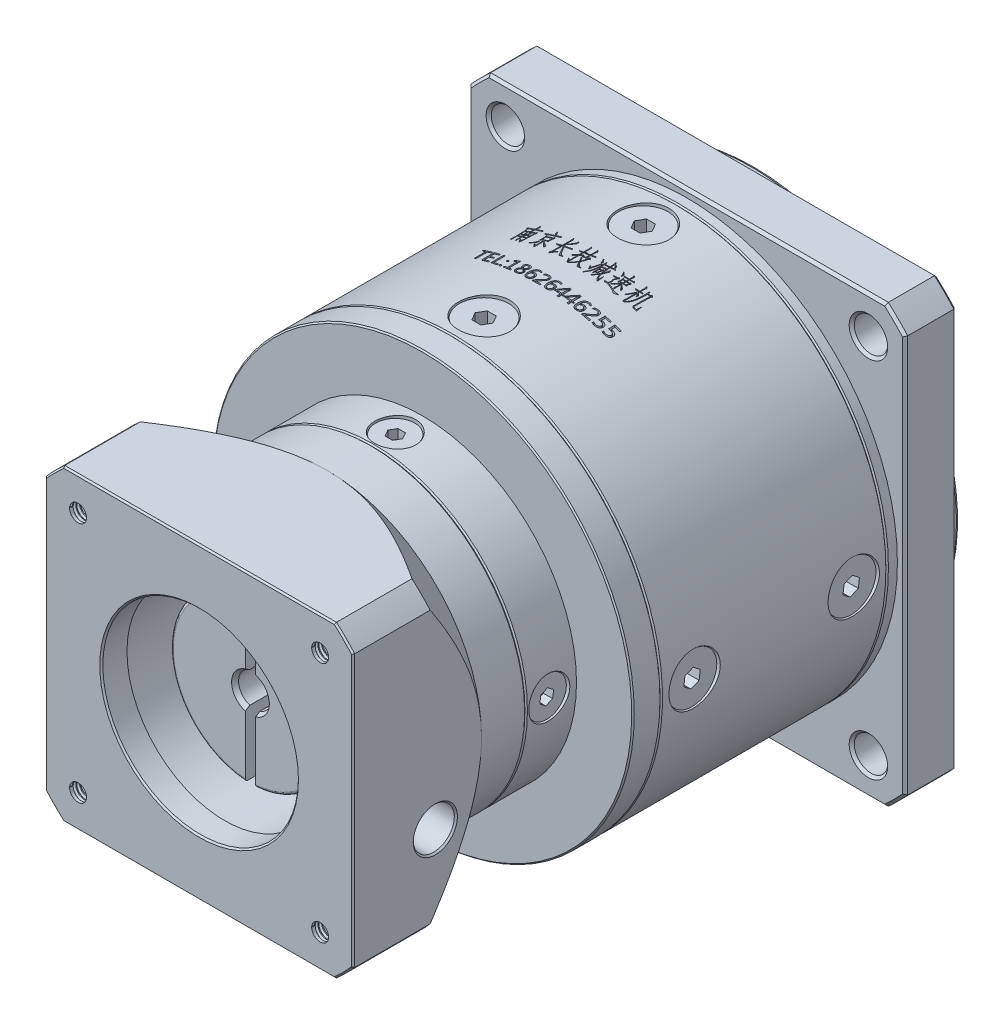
SolidWorks part; units mm, degrees
ref_plane "前视基准面" through (0, 0, 0) normal (0, 0, 1) x (1, 0, 0)
ref_plane "上视基准面" through (0, 0, 0) normal (0, 1, 0) x (1, 0, 0)
ref_plane "右视基准面" through (0, 0, 0) normal (1, 0, 0) x (0, 0, -1)
imported_body "6.35-38.1-47.14X47.14-M4-1-solid1"
imported_body "6.35-38.1-47.14X47.14-M4-1-solid2"
imported_body "6.35-38.1-47.14X47.14-M4-1-solid3"
imported_body "6.35-38.1-47.14X47.14-M4-1-solid4"
imported_body "6.35-38.1-47.14X47.14-M4-1-solid5"
imported_body "ZF80-K15-L2-F60-1-solid1"
imported_body "ZF80-K15-L2-F60-1-solid2"
imported_body "ZF80-K15-L2-F60-1-solid3"
imported_body "ZF80-K15-L2-F60-1-solid4"
imported_body "ZF80-K15-L2-F60-1-solid5"
imported_body "ZF80-K15-L2-F60-1-solid6"
imported_body "ZF80-K15-L2-F60-1-solid7"
imported_body "ZF80-K15-L2-F60-1-solid8"
imported_body "ZF80-K15-L2-F60-1-solid9"
imported_body "ZF80-K15-L2-F60-1-solid10"
imported_body "ZF80-K15-L2-F60-1-solid11"
imported_body "ZF80-K15-L2-F60-1-solid12"
imported_body "ZF80-K15-L2-F60-1-solid13"
sketch "草图1" plane through (0, 0, -59.9749) normal (0, 0, -1) x (-1, 0, 0)
  circle A0 centre (59.6015, 24.5034) radius 11.0353
  dimension "D1" = 22.0705
extrude "凸台-拉伸1" add sketch "草图1" along normal blind 5
